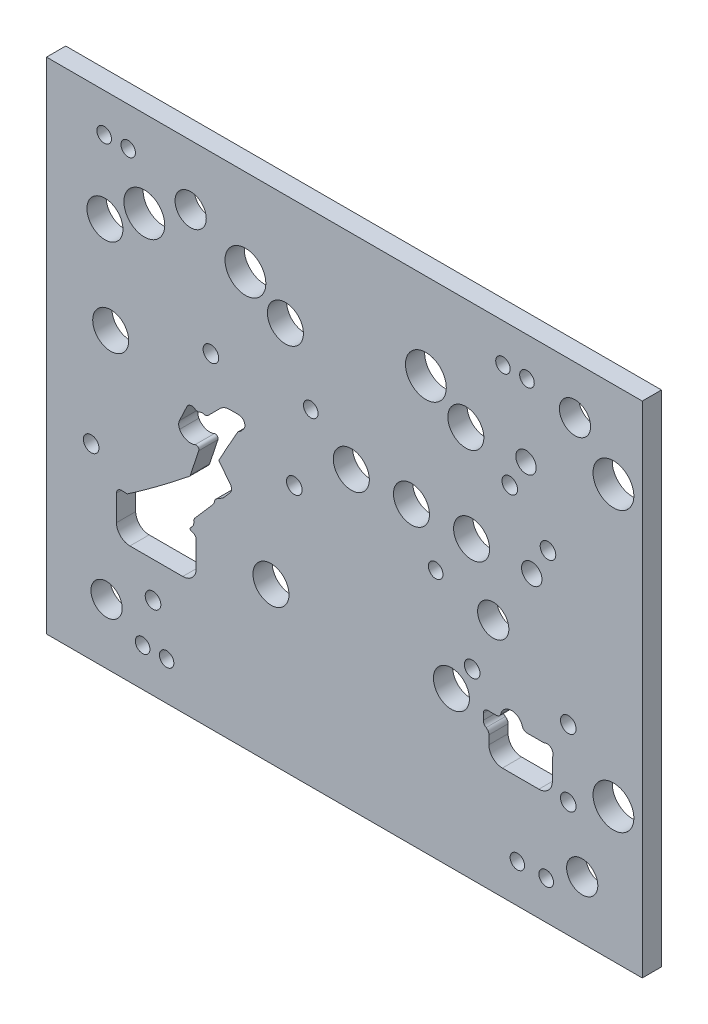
SolidWorks part; units mm, degrees
ref_plane "Front" through (0, 0, 0) normal (0, 0, 1) x (1, 0, 0)
ref_plane "Top" through (0, 0, 0) normal (0, 1, 0) x (1, 0, 0)
ref_plane "Right" through (0, 0, 0) normal (1, 0, 0) x (0, 0, -1)
sketch "Sketch1" plane through (0, 0, 0) normal (0, 0, 1) x (1, 0, 0)
  line L4 (-57.15, 149.225) -> (-450.85, 149.225)
  line L5 (-450.85, 149.225) -> (-450.85, -180.975)
  line L6 (-450.85, -180.975) -> (-57.15, -180.975)
  line L7 (-57.15, -180.975) -> (-57.15, 149.225)
  line L8 (-57.15, 149.225) -> (-450.85, 149.225)
  line L9 (-450.85, 149.225) -> (-450.85, -180.975)
  line L10 (-450.85, -180.975) -> (-57.15, -180.975)
  line L11 (-57.15, -180.975) -> (-57.15, 149.225)
  dimension "D1" = 0
extrude "Boss-Extrude1" add sketch "Sketch1" along normal blind 12.7 separate body
hole_wizard "Hole1" positions "Point_Sketch" profile "Profil_Sketch" hole size "Ø0.15" standard "ISO"
sketch "Point_Sketch" plane through (-130.0193, 32.8261, 12.7) normal (0, 0, -1) x (1, 0, 0)
  point P0 (-0.1557, 18.8561)
  point P2 (-3.9657, -43.0691)
sketch "Profil_Sketch" plane through (-130.175, 13.97, 12.7) normal (1, 0, 0) x (0, -1, 0)
  line L0 (0, 0) -> (0, 12.7)
  line L1 (0, 12.7) -> (6.7469, 12.7)
  line L2 (6.7469, 12.7) -> (6.7469, 0)
  line L5 (6.7469, 0) -> (0, 0)
  line L11 (0, -6.35) -> (0, 107.95) construction
  dimension "Diameter" = 13.4937
  dimension "Thru Hole Depth" = 12.7
other "usin_DL090<1>"
hole_wizard "Hole11" positions "Point_Sketch1" profile "Profil_Sketch1" hole size "Ø0.15" standard "ISO"
sketch "Point_Sketch1" plane through (-35.4043, 98.1359, 12.7) normal (0, 0, -1) x (1, 0, 0)
  point P0 (-40.7957, 6.0609)
  point P2 (-40.7957, 190.4649)
  point P4 (-164.7477, 6.0609)
  point P6 (-284.0007, 6.0609)
  point P8 (-350.8027, 6.0609)
sketch "Profil_Sketch1" plane through (-76.2, 92.075, 12.7) normal (1, 0, 0) x (0, -1, 0)
  line L0 (0, 0) -> (0, 12.7)
  line L1 (0, 12.7) -> (13.4937, 12.7)
  line L2 (13.4937, 12.7) -> (13.4937, 0)
  line L5 (13.4937, 0) -> (0, 0)
  line L11 (0, -6.35) -> (0, 107.95) construction
  dimension "Diameter" = 26.9875
  dimension "Thru Hole Depth" = 12.7
other "usin_DL090<2>"
hole_wizard "Hole12" positions "Point_Sketch2" profile "Profil_Sketch2" hole size "Ø0.15" standard "ISO"
sketch "Point_Sketch2" plane through (-32.2293, -113.2239, 12.7) normal (0, 0, -1) x (1, 0, 0)
  point P0 (-88.4207, 42.3511)
  point P2 (-355.1207, 42.3511)
  point P4 (-380.5207, -237.0489)
  point P6 (-101.1207, -237.0489)
  point P8 (-243.9957, -148.1489)
  point P10 (-161.4457, -97.3489)
sketch "Profil_Sketch2" plane through (-120.65, -155.575, 12.7) normal (1, 0, 0) x (0, -1, 0)
  line L0 (0, 0) -> (0, 12.7)
  line L1 (0, 12.7) -> (4.826, 12.7)
  line L2 (4.826, 12.7) -> (4.826, 0)
  line L5 (4.826, 0) -> (0, 0)
  line L11 (0, -6.35) -> (0, 107.95) construction
  dimension "Diameter" = 9.652
  dimension "Thru Hole Depth" = 12.7
other "usin_DL090_.375-16x1.75-SHCS<3>"
hole_wizard "Hole13" positions "Point_Sketch3" profile "Profil_Sketch3" hole size "Ø0.15" standard "ISO"
sketch "Point_Sketch3" plane through (-345.5957, 115.3761, 0) normal (0, 0, 1) x (-1, 0, 0)
  point P0 (51.2793, -8.4489)
  point P2 (25.8793, 270.9511)
  point P4 (-205.8957, 270.9511)
  point P6 (-196.3707, -8.4489)
sketch "Profil_Sketch3" plane through (-396.875, 123.825, 0) normal (1, 0, 0) x (0, 1, 0)
  line L0 (0, 0) -> (0, 12.7)
  line L1 (0, 12.7) -> (4.7752, 12.7)
  line L2 (4.7752, 12.7) -> (4.7752, 0)
  line L5 (4.7752, 0) -> (0, 0)
  line L11 (0, -6.35) -> (0, 107.95) construction
  dimension "Diameter" = 9.5504
  dimension "Thru Hole Depth" = 12.7
other "usin_DL090_.375 x 2.00 DOWEL PIN<4>"
hole_wizard "Hole14" positions "Point_Sketch4" profile "Profil_Sketch4" hole size "Ø0.15" standard "ISO"
sketch "Point_Sketch4" plane through (-65.2493, -43.3739, 12.7) normal (0, 0, -1) x (1, 0, 0)
  point P0 (-40.7957, 16.9511)
  point P2 (-40.7957, 61.4011)
  point P4 (-104.2957, 16.9511)
sketch "Profil_Sketch4" plane through (-106.045, -60.325, 12.7) normal (1, 0, 0) x (0, -1, 0)
  line L0 (0, 0) -> (0, 12.7)
  line L1 (0, 12.7) -> (5.1562, 12.7)
  line L2 (5.1562, 12.7) -> (5.1562, 0)
  line L5 (5.1562, 0) -> (0, 0)
  line L11 (0, -6.35) -> (0, 107.95) construction
  dimension "Diameter" = 10.3124
  dimension "Thru Hole Depth" = 12.7
other "usin_DL090_.375-16x1.75-SHCS<5>"
hole_wizard "Hole15" positions "Point_Sketch5" profile "Profil_Sketch5" hole size "Ø0.15" standard "ISO"
sketch "Point_Sketch5" plane through (-324.5757, -14.4605, 12.7) normal (0, 0, -1) x (1, 0, 0)
  point P0 (-17.6637, -48.2631)
  point P2 (37.4724, -0.3814)
  point P4 (-55.8939, 111.9726)
  point P6 (-96.7727, 42.8312)
sketch "Profil_Sketch5" plane through (-342.2394, 33.8027, 12.7) normal (1, 0, 0) x (0, -1, 0)
  line L0 (0, 0) -> (0, 12.7)
  line L1 (0, 12.7) -> (5.1562, 12.7)
  line L2 (5.1562, 12.7) -> (5.1562, 0)
  line L5 (5.1562, 0) -> (0, 0)
  line L11 (0, -6.35) -> (0, 107.95) construction
  dimension "Diameter" = 10.3124
  dimension "Thru Hole Depth" = 12.7
other "usin_DL090_.375-16x1.75-SHCS<6>"
hole_wizard "Hole19" positions "Point_Sketch9" profile "Profil_Sketch9" hole size "Ø0.15" standard "ISO"
sketch "Point_Sketch9" plane through (-124.3043, 112.2011, 12.7) normal (0, 0, -1) x (1, 0, 0)
  point P0 (22.7043, -5.2739)
  point P2 (27.4668, 255.0761)
  point P4 (-286.8582, 253.4886)
  point P6 (-231.2957, 2.6636)
sketch "Profil_Sketch9" plane through (-101.6, 117.475, 12.7) normal (1, 0, 0) x (0, -1, 0)
  line L0 (0, 0) -> (0, 12.7)
  line L1 (0, 12.7) -> (10.3187, 12.7)
  line L2 (10.3187, 12.7) -> (10.3187, 0)
  line L5 (10.3187, 0) -> (0, 0)
  line L11 (0, -6.35) -> (0, 107.95) construction
  dimension "Diameter" = 20.6375
  dimension "Thru Hole Depth" = 12.7
other "usin_DL090<10>"
hole_wizard "Hole111" positions "Point_Sketch11" profile "Profil_Sketch11" hole size "Ø0.15" standard "ISO"
sketch "Point_Sketch11" plane through (-113.5568, -0.8289, 12.7) normal (0, 0, -1) x (1, 0, 0)
  point P0 (-42.0817, 24.5711)
sketch "Profil_Sketch11" plane through (-155.6385, -25.4, 12.7) normal (1, 0, 0) x (0, -1, 0)
  line L0 (0, 0) -> (0, 12.7)
  line L1 (0, 12.7) -> (10.3187, 12.7)
  line L2 (10.3187, 12.7) -> (10.3187, 0)
  line L5 (10.3187, 0) -> (0, 0)
  line L11 (0, -6.35) -> (0, 107.95) construction
  dimension "Diameter" = 20.6375
  dimension "Thru Hole Depth" = 12.7
other "usin_DL090<11>"
hole_wizard "Hole112" positions "Point_Sketch12" profile "Profil_Sketch12" hole size "Ø0.15" standard "ISO"
sketch "Point_Sketch12" plane through (-130.0193, 56.6386, 12.7) normal (0, 0, -1) x (1, 0, 0)
  point P0 (10.5599, 24.1086)
  point P2 (-14.6814, -0.6966)
sketch "Profil_Sketch12" plane through (-119.4594, 32.53, 12.7) normal (1, 0, 0) x (0, -1, 0)
  line L0 (0, 0) -> (0, 12.7)
  line L1 (0, 12.7) -> (5.1594, 12.7)
  line L2 (5.1594, 12.7) -> (5.1594, 0)
  line L5 (5.1594, 0) -> (0, 0)
  line L11 (0, -6.35) -> (0, 107.95) construction
  dimension "Diameter" = 10.3187
  dimension "Thru Hole Depth" = 12.7
other "usin_DL090<12>"
hole_wizard "Hole113" positions "Point_Sketch13" profile "Profil_Sketch13" hole size "Ø0.15" standard "ISO"
sketch "Point_Sketch13" plane through (-170.0817, 86.4963, 0) normal (0, 0, 1) x (-1, 0, 0)
  point P0 (3.6543, 10.6011)
  point P4 (39.5953, 72.5263)
  point P6 (79.3463, 72.5263)
  point P8 (122.9073, 10.6011)
  point P10 (242.1603, 10.6011)
  point P12 (238.3503, 72.5263)
  point P14 (13.1793, 164.8553)
  point P16 (132.4323, 164.8553)
  point P18 (-0.1557, 72.5263)
sketch "Profil_Sketch13" plane through (-173.736, 75.8952, 0) normal (1, 0, 0) x (0, 1, 0)
  line L0 (0, 0) -> (0, 12.7)
  line L1 (0, 12.7) -> (11.9062, 12.7)
  line L2 (11.9062, 12.7) -> (11.9062, 0)
  line L5 (11.9062, 0) -> (0, 0)
  line L11 (0, -6.35) -> (0, 107.95) construction
  dimension "Diameter" = 23.8125
  dimension "Thru Hole Depth" = 12.7
other "usin_DL090<13>"
ref_plane "Plane1 QU250515L_Punch[Mounted in the strip]-3"
sketch "Sketch1 QU250515L_Punch[Mounted in the strip]-3" plane through (0, 0, 12.7) normal (0, 0, 1) x (1, 0, 0)
  line L6 (-122.1095, -78.867) -> (-136.1997, -78.867)
  line L7 (-116.586, -98.171) -> (-116.586, -84.3905)
  line L8 (-149.606, -107.061) -> (-125.476, -107.061)
  line L9 (-158.496, -88.8003) -> (-158.496, -98.171)
  line L10 (-161.4659, -83.8742) -> (-159.3874, -86.3513)
  line L11 (-150.8203, -78.867) -> (-159.131, -78.867)
  line L12 (-122.1095, -78.867) -> (-136.1997, -78.867)
  line L13 (-116.586, -98.171) -> (-116.586, -84.3905)
  line L14 (-149.606, -107.061) -> (-125.476, -107.061)
  line L15 (-158.496, -88.8003) -> (-158.496, -98.171)
  line L16 (-161.4659, -83.8742) -> (-159.3874, -86.3513)
  line L17 (-150.8203, -78.867) -> (-159.131, -78.867)
  arc A10 (-116.586, -84.3905) -> (-122.1095, -78.867) centre (-120.142, -82.423) ccw
  arc A11 (-125.476, -107.061) -> (-116.586, -98.171) centre (-125.476, -98.171) ccw
  arc A12 (-158.496, -98.171) -> (-149.606, -107.061) centre (-149.606, -98.171) ccw
  arc A13 (-158.496, -88.8003) -> (-159.3874, -86.3513) centre (-162.306, -88.8003) ccw
  arc A14 (-159.131, -78.867) -> (-161.4659, -83.8742) centre (-159.131, -81.915) ccw
  arc A15 (-136.1997, -78.867) -> (-150.8203, -78.867) centre (-143.51, -78.359) ccw
  arc A16 (-116.586, -84.3905) -> (-122.1095, -78.867) centre (-120.142, -82.423) ccw
  arc A17 (-125.476, -107.061) -> (-116.586, -98.171) centre (-125.476, -98.171) ccw
  arc A18 (-158.496, -98.171) -> (-149.606, -107.061) centre (-149.606, -98.171) ccw
  arc A19 (-158.496, -88.8003) -> (-159.3874, -86.3513) centre (-162.306, -88.8003) ccw
  arc A20 (-159.131, -78.867) -> (-161.4659, -83.8742) centre (-159.131, -81.915) ccw
  arc A21 (-136.1997, -78.867) -> (-150.8203, -78.867) centre (-143.51, -78.359) ccw
ref_plane "Plane1 QU250515L_Punch26[Mounted in the strip]-1"
sketch "Sketch1 QU250515L_Punch26[Mounted in the strip]-1" plane through (0, 0, 12.7) normal (0, 0, 1) x (1, 0, 0)
  line L23 (-323.8215, 8.0488) -> (-329.8669, 8.0488)
  line L24 (-328.7765, -9.8253) -> (-326.5979, -5.8377)
  line L25 (-331.3589, -14.3223) -> (-328.7765, -9.8253)
  line L26 (-337.0265, -24.6962) -> (-331.3589, -14.3223)
  line L27 (-329.45, -34.3839) -> (-337.0265, -24.6962)
  line L28 (-333.4393, -43.993) -> (-329.5828, -39.5523)
  line L29 (-339.8494, -48.2536) -> (-334.7534, -45.1094)
  line L30 (-353.6765, -66.587) -> (-340.7652, -51.7196)
  line L31 (-353.5046, -67.6786) -> (-353.5617, -67.2072)
  line L32 (-358.8891, -74.0611) -> (-358.2432, -73.3174)
  line L33 (-355.0636, -74.2414) -> (-358.8891, -74.0611)
  line L34 (-351.917, -94.107) -> (-351.917, -77.5397)
  line L35 (-395.732, -102.997) -> (-360.807, -102.997)
  line L36 (-404.622, -77.2405) -> (-404.622, -94.107)
  line L37 (-397.6596, -74.1073) -> (-401.1646, -73.9421)
  line L38 (-391.6423, -70.0677) -> (-395.519, -72.7205)
  line L39 (-350.2435, -25.7517) -> (-356.0481, -43.2103)
  line L40 (-358.0985, -4.4553) -> (-362.9867, -14.8436)
  line L41 (-351.1267, -4.5468) -> (-352.5743, -3.2897)
  line L42 (-336.153, 5.445) -> (-345.4177, -3.8197)
  line L43 (-323.8215, 8.0488) -> (-329.8669, 8.0488)
  line L44 (-328.7765, -9.8253) -> (-326.5979, -5.8377)
  line L45 (-331.3589, -14.3223) -> (-328.7765, -9.8253)
  line L46 (-337.0265, -24.6962) -> (-331.3589, -14.3223)
  line L47 (-329.45, -34.3839) -> (-337.0265, -24.6962)
  line L48 (-333.4393, -43.993) -> (-329.5828, -39.5523)
  line L49 (-339.8494, -48.2536) -> (-334.7534, -45.1094)
  line L50 (-353.6765, -66.587) -> (-340.7652, -51.7196)
  line L51 (-353.5046, -67.6786) -> (-353.5617, -67.2072)
  line L52 (-358.8891, -74.0611) -> (-358.2432, -73.3174)
  line L53 (-355.0636, -74.2414) -> (-358.8891, -74.0611)
  line L54 (-351.917, -94.107) -> (-351.917, -77.5397)
  line L55 (-395.732, -102.997) -> (-360.807, -102.997)
  line L56 (-404.622, -77.2405) -> (-404.622, -94.107)
  line L57 (-397.6596, -74.1073) -> (-401.1646, -73.9421)
  line L58 (-391.6423, -70.0677) -> (-395.519, -72.7205)
  line L59 (-350.2435, -25.7517) -> (-356.0481, -43.2103)
  line L60 (-358.0985, -4.4553) -> (-362.9867, -14.8436)
  line L61 (-351.1267, -4.5468) -> (-352.5743, -3.2897)
  line L62 (-336.153, 5.445) -> (-345.4177, -3.8197)
  arc A36 (-321.4233, 0.7038) -> (-323.8215, 8.0488) centre (-323.8215, 3.9848) ccw
  arc A37 (-321.4233, 0.7038) -> (-321.5014, 0.5256) centre (-274.8211, -19.8428) ccw
  arc A38 (-323.9053, -1.3173) -> (-321.5014, 0.5256) centre (-324.369, 1.7768) ccw
  arc A39 (-323.9053, -1.3173) -> (-325.7536, -4.3751) centre (-213.8052, -69.9538) ccw
  arc A40 (-325.7536, -4.3751) -> (-326.1833, -5.0994) centre (-295.3841, -22.8808) ccw
  arc A41 (-326.1833, -5.0994) -> (-326.5979, -5.8377) centre (-246.2982, -50.4461) ccw
  arc A42 (-329.5828, -39.5523) -> (-329.45, -34.3839) centre (-332.6513, -36.8875) ccw
  arc A43 (-334.7534, -45.1094) -> (-333.4393, -43.993) centre (-337.7543, -40.2457) ccw
  arc A44 (-340.7652, -51.7196) -> (-339.8494, -48.2536) centre (-343.8336, -49.0549) ccw
  arc A45 (-353.5617, -67.2072) -> (-353.6765, -66.587) centre (-358.5651, -67.813) ccw
  arc A46 (-358.2432, -73.3174) -> (-353.5046, -67.6786) centre (-358.5081, -68.2843) ccw
  arc A47 (-351.917, -77.5397) -> (-355.0636, -74.2414) centre (-355.219, -77.5397) ccw
  arc A48 (-360.807, -102.997) -> (-351.917, -94.107) centre (-360.807, -94.107) ccw
  arc A49 (-404.622, -94.107) -> (-395.732, -102.997) centre (-395.732, -94.107) ccw
  arc A50 (-401.1646, -73.9421) -> (-404.622, -77.2405) centre (-401.32, -77.2405) ccw
  arc A51 (-397.6596, -74.1073) -> (-397.3408, -74.0135) centre (-397.6357, -73.5999) ccw
  arc A52 (-395.519, -72.7205) -> (-397.3408, -74.0135) centre (-95.1891, -497.8086) ccw
  arc A53 (-391.6423, -70.0677) -> (-356.0481, -43.2103) centre (-793.7243, 499.8274) ccw
  arc A54 (-350.2435, -25.7517) -> (-352.6446, -23.5047) centre (-351.961, -25.1806) ccw
  arc A55 (-362.8709, -19.7898) -> (-352.6446, -23.5047) centre (-355.7059, -15.999) ccw
  arc A56 (-362.9867, -14.8436) -> (-362.8709, -19.7898) centre (-357.9773, -17.2007) ccw
  arc A57 (-352.5743, -3.2897) -> (-358.0985, -4.4553) centre (-354.8954, -5.9625) ccw
  arc A58 (-345.4177, -3.8197) -> (-351.1267, -4.5468) centre (-347.9097, -7.0301) ccw
  arc A59 (-329.8669, 8.0488) -> (-336.153, 5.445) centre (-329.8669, -0.8412) ccw
  arc A60 (-321.4233, 0.7038) -> (-323.8215, 8.0488) centre (-323.8215, 3.9848) ccw
  arc A61 (-321.4233, 0.7038) -> (-321.5014, 0.5256) centre (-274.8211, -19.8428) ccw
  arc A62 (-323.9053, -1.3173) -> (-321.5014, 0.5256) centre (-324.369, 1.7768) ccw
  arc A63 (-323.9053, -1.3173) -> (-325.7536, -4.3751) centre (-213.8052, -69.9538) ccw
  arc A64 (-325.7536, -4.3751) -> (-326.1833, -5.0994) centre (-295.3841, -22.8808) ccw
  arc A65 (-326.1833, -5.0994) -> (-326.5979, -5.8377) centre (-246.2982, -50.4461) ccw
  arc A66 (-329.5828, -39.5523) -> (-329.45, -34.3839) centre (-332.6513, -36.8875) ccw
  arc A67 (-334.7534, -45.1094) -> (-333.4393, -43.993) centre (-337.7543, -40.2457) ccw
  arc A68 (-340.7652, -51.7196) -> (-339.8494, -48.2536) centre (-343.8336, -49.0549) ccw
  arc A69 (-353.5617, -67.2072) -> (-353.6765, -66.587) centre (-358.5651, -67.813) ccw
  arc A70 (-358.2432, -73.3174) -> (-353.5046, -67.6786) centre (-358.5081, -68.2843) ccw
  arc A71 (-351.917, -77.5397) -> (-355.0636, -74.2414) centre (-355.219, -77.5397) ccw
  arc A72 (-360.807, -102.997) -> (-351.917, -94.107) centre (-360.807, -94.107) ccw
  arc A73 (-404.622, -94.107) -> (-395.732, -102.997) centre (-395.732, -94.107) ccw
  arc A74 (-401.1646, -73.9421) -> (-404.622, -77.2405) centre (-401.32, -77.2405) ccw
  arc A75 (-397.6596, -74.1073) -> (-397.3408, -74.0135) centre (-397.6357, -73.5999) ccw
  arc A76 (-395.519, -72.7205) -> (-397.3408, -74.0135) centre (-95.1891, -497.8086) ccw
  arc A77 (-391.6423, -70.0677) -> (-356.0481, -43.2103) centre (-793.7243, 499.8274) ccw
  arc A78 (-350.2435, -25.7517) -> (-352.6446, -23.5047) centre (-351.961, -25.1806) ccw
  arc A79 (-362.8709, -19.7898) -> (-352.6446, -23.5047) centre (-355.7059, -15.999) ccw
  arc A80 (-362.9867, -14.8436) -> (-362.8709, -19.7898) centre (-357.9773, -17.2007) ccw
  arc A81 (-352.5743, -3.2897) -> (-358.0985, -4.4553) centre (-354.8954, -5.9625) ccw
  arc A82 (-345.4177, -3.8197) -> (-351.1267, -4.5468) centre (-347.9097, -7.0301) ccw
  arc A83 (-329.8669, 8.0488) -> (-336.153, 5.445) centre (-329.8669, -0.8412) ccw
extrude "Cut-Extrude1 QU250515L_Punch26[Mounted in the strip]-1" cut sketch "Sketch1 QU250515L_Punch26[Mounted in the strip]-1" against normal through all
extrude "Cut-Extrude1 QU250515L_Punch[Mounted in the strip]-3" cut sketch "Sketch1 QU250515L_Punch[Mounted in the strip]-3" against normal through all
sketch "Sketch2" plane through (0, 0, 12.7) normal (0, 0, 1) x (1, 0, 0)
  line L0 (-355.0636, -74.2414) -> (-358.8891, -74.0611) construction
  line L1 (-355.0636, -74.2414) -> (-358.8891, -74.0611)
  line L2 (-358.8891, -74.0611) -> (-358.2432, -73.3174) construction
  line L3 (-358.8891, -74.0611) -> (-358.2432, -73.3174)
  arc A0 (-351.917, -77.5397) -> (-355.0636, -74.2414) centre (-355.219, -77.5397) ccw construction
  arc A1 (-358.2432, -73.3174) -> (-353.5046, -67.6786) centre (-358.5081, -68.2843) ccw construction
  arc A2 (-355.058, -74.2416) -> (-355.0636, -74.2414) centre (-355.219, -77.5397) ccw
  arc A3 (-358.2432, -73.3174) -> (-355.5956, -72.3977) centre (-358.5081, -68.2843) ccw
  arc A4 (-355.5956, -72.3977) -> (-355.058, -74.2416) centre (-355.0085, -73.2268) ccw
  dimension "D1" = 1.016
extrude "Cut-Extrude1" cut sketch "Sketch2" against normal through all
fillet "Fillet1" radius 3.175 10 edges at (-356.0481, -43.2103, 6.35) (-323.9053, -1.3173, 6.35) (-345.4177, -3.8197, 6.35) (-351.1267, -4.5468, 6.35) (-339.8494, -48.2536, 6.35) (-353.6765, -66.587, 6.35) (-116.586, -84.3905, 6.35) (-122.1095, -78.867, 6.35) (-150.8203, -78.867, 6.35) (-136.1997, -78.867, 6.35)
sketch "Sketch1 _Machining axis" plane through (0, 0, 12.7) normal (0, 0, 1) x (1, 0, 0)
  line L0 (-378.2695, -97.917) -> (-378.2695, -102.997) construction
  line L1 (-395.732, -102.997) -> (-360.807, -102.997) construction
  line L2 (-137.541, -101.981) -> (-137.541, -107.061) construction
  line L3 (-149.606, -107.061) -> (-125.476, -107.061) construction
  point P0 (-378.2695, -97.917)
  point P5 (-137.541, -101.981)
sketch "Sketch1 _Wire EDM" plane through (0, 0, 12.7) normal (0, 0, 1) x (1, 0, 0)
  circle A0 centre (-378.2695, -97.917) radius 3.175
  circle A1 centre (-137.541, -101.981) radius 3.175
sketch "Sketch3" plane through (0, 0, 12.7) normal (0, 0, 1) x (1, 0, 0)
  line L1 (-158.496, -88.8003) -> (-158.496, -98.171) construction
  line L2 (-162.179, -81.915) -> (-162.179, -85.979)
  line L3 (-162.179, -81.915) -> (-162.179, -85.979)
  line L4 (-161.4659, -83.8742) -> (-159.3874, -86.3513) construction
  line L5 (-158.496, -92.5003) -> (-158.496, -88.8003)
  line L6 (-161.4659, -83.8742) -> (-159.3874, -86.3513)
  arc A1 (-158.496, -88.8003) -> (-159.3874, -86.3513) centre (-162.306, -88.8003) ccw construction
  arc A2 (-162.179, -85.979) -> (-157.7623, -89.7374) centre (-158.3715, -85.979) ccw
  arc A3 (-162.179, -85.979) -> (-160.3375, -89.2396) centre (-158.3715, -85.979) ccw
  arc A4 (-159.131, -78.867) -> (-161.4659, -83.8742) centre (-159.131, -81.915) ccw construction
  arc A5 (-158.496, -88.8003) -> (-159.3874, -86.3513) centre (-162.306, -88.8003) ccw
  arc A6 (-162.179, -81.915) -> (-161.4659, -83.8742) centre (-159.131, -81.915) ccw
  arc A7 (-160.3375, -89.2396) -> (-158.496, -92.5003) centre (-162.3035, -92.5003) cw
  dimension "D1" = 2.22
extrude "Cut-Extrude2" cut sketch "Sketch3" against normal through all
